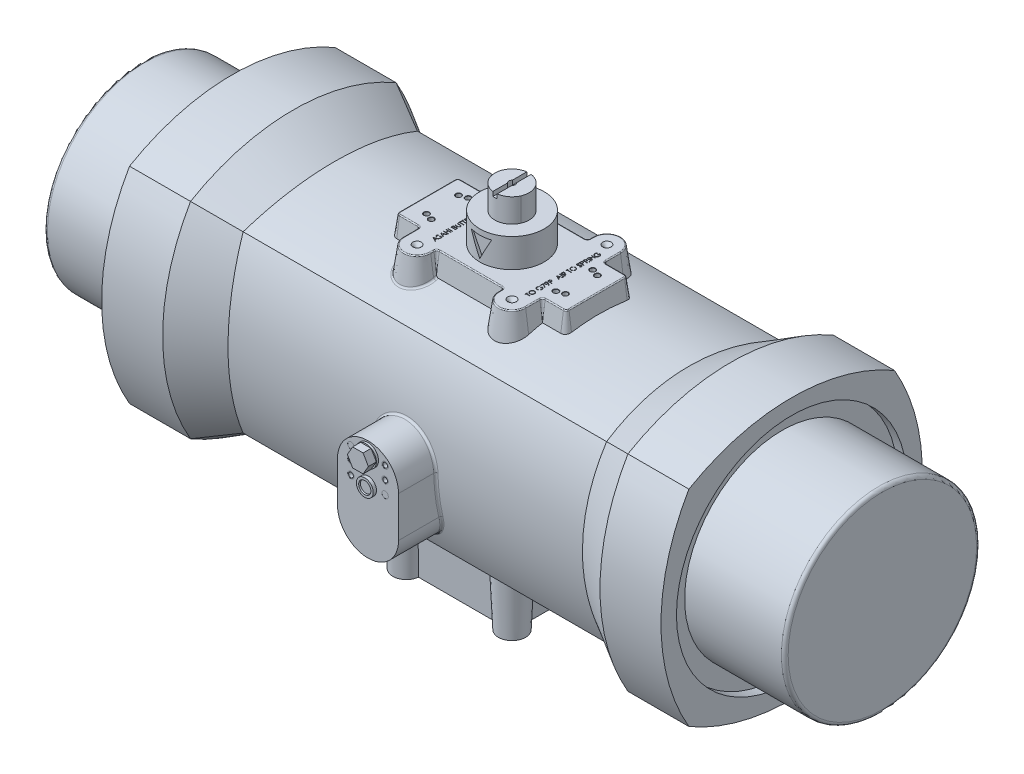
SolidWorks part; units mm, degrees
ref_plane "Front" through (0, 0, 0) normal (0, 0, 1) x (1, 0, 0)
ref_plane "Top" through (0, 0, 0) normal (0, 1, 0) x (1, 0, 0)
ref_plane "Right" through (0, 0, 0) normal (1, 0, 0) x (0, 0, -1)
sketch "Sketch1" plane through (0, 0, 0) normal (1, 0, 0) x (0, 0, -1)
  line L0 (0, 0) -> (-111.6723, 0) construction
  line L1 (0, 0) -> (0, 113.5403) construction
  circle A0 centre (0, 0) radius 72.39 construction
  circle A1 centre (0, 0) radius 100.0125 construction
  arc A2 (81.6346, 81.6346) -> (-81.6346, 81.6346) centre (0, -90.4875) ccw
  arc A3 (81.6346, -81.6346) -> (-81.6346, -81.6346) centre (0, 90.4875) cw
  arc A4 (-81.6346, 81.6346) -> (-81.6346, -81.6346) centre (90.4875, 0) ccw
  arc A5 (81.6346, 81.6346) -> (81.6346, -81.6346) centre (-90.4875, 0) cw
  dimension "D1" = 144.78
  dimension "D2" = 200.025
  dimension "D3" = 381
  dimension "D4" = 381
extrude "BODY DIA" add sketch "Sketch1" along normal mid plane 524.002
sketch "Sketch2" plane through (262.001, 0, 0) normal (1, 0, 0) x (0, 0, -1)
  line L0 (0, 0) -> (0, 112.2833) construction
  line L1 (0, 0) -> (-109.8095, 0) construction
  arc A0 (96.2969, 96.2969) -> (-96.2969, 96.2969) centre (0, -68.072) ccw
  arc A1 (96.2969, -96.2969) -> (-96.2969, -96.2969) centre (0, 68.072) cw
  arc A2 (-96.2969, 96.2969) -> (-96.2969, -96.2969) centre (68.072, 0) ccw
  arc A3 (96.2969, 96.2969) -> (96.2969, -96.2969) centre (-68.072, 0) cw
  circle A4 centre (0, 0) radius 122.428 construction
  dimension "D3" = 244.856
  dimension "D1" = 381
  dimension "D2" = 381
extrude "END1" add sketch "Sketch2" against normal blind 57.15
mirror "END2" about plane through (0, 0, 0) normal (1, 0, 0) of "END1"
sketch "Sketch3" plane through (204.851, 0, 0) normal (-1, 0, 0) x (0, 0, 1)
  arc A5 (96.2969, -96.2969) -> (96.2969, 96.2969) centre (-68.072, 0) ccw construction
  arc A6 (-96.2969, -96.2969) -> (96.2969, -96.2969) centre (0, 68.072) ccw construction
  arc A7 (-96.2969, 96.2969) -> (-96.2969, -96.2969) centre (68.072, 0) ccw construction
  arc A8 (96.2969, 96.2969) -> (-96.2969, 96.2969) centre (0, -68.072) ccw construction
  arc A9 (96.2969, -96.2969) -> (96.2969, 96.2969) centre (-68.072, 0) ccw
  arc A10 (-96.2969, -96.2969) -> (96.2969, -96.2969) centre (0, 68.072) ccw
  arc A11 (-96.2969, 96.2969) -> (-96.2969, -96.2969) centre (68.072, 0) ccw
  arc A12 (96.2969, 96.2969) -> (-96.2969, 96.2969) centre (0, -68.072) ccw
extrude "END DRAFT1" add sketch "Sketch3" along normal blind 50.8 draft 30
mirror "END DRAFT2" about plane through (0, 0, 0) normal (1, 0, 0) of "END DRAFT1"
sketch "Sketch4" plane through (262.001, 0, 0) normal (1, 0, 0) x (0, 0, -1)
  circle A0 centre (0, 0) radius 107.95
  circle A1 centre (0, 0) radius 91.44
  dimension "D1" = 16.51
  dimension "D2" = 215.9
extrude "END DIA DETAIL1" cut sketch "Sketch4" against normal blind 8.89
mirror "END DIA DETAIL2" about plane through (0, 0, 0) normal (1, 0, 0) of "END DIA DETAIL1"
ref_plane "Plane1" through (0, -147.32, 0) normal (0, 1, 0) x (-1, 0, 0)
ref_plane "Plane2" through (0, 115.57, 0) normal (0, 1, 0) x (-1, 0, 0)
sketch "Sketch5" plane through (0, -147.32, 0) normal (0, 1, 0) x (-1, 0, 0)
  line L0 (0, 0) -> (0, 75.2294) construction
  line L1 (0, 0) -> (92.8969, 0) construction
  line L2 (-49.4812, 49.4812) -> (0, 0) construction
  line L5 (50.8, 36.8499) -> (50.8, -36.8499)
  line L6 (36.8499, -50.8) -> (-36.8499, -50.8)
  line L7 (-50.8, 36.8499) -> (-50.8, -36.8499)
  line L8 (36.8499, 50.8) -> (-36.8499, 50.8)
  circle A0 centre (0, 0) radius 69.977 construction
  arc A1 (57.8778, 41.0847) -> (41.0847, 57.8778) centre (49.4812, 49.4812) ccw construction
  arc A2 (-57.8778, 41.0847) -> (-41.0847, 57.8778) centre (-49.4812, 49.4812) cw construction
  arc A3 (-57.8778, -41.0847) -> (-41.0847, -57.8778) centre (-49.4812, -49.4812) ccw construction
  arc A4 (57.8778, -41.0847) -> (41.0847, -57.8778) centre (49.4812, -49.4812) cw construction
  arc A5 (-36.8499, 50.8) -> (-50.8, 36.8499) centre (-49.4812, 49.4812) ccw
  arc A6 (50.8, 36.8499) -> (36.8499, 50.8) centre (49.4812, 49.4812) ccw
  arc A7 (36.8499, -50.8) -> (50.8, -36.8499) centre (49.4812, -49.4812) ccw
  arc A8 (-50.8, -36.8499) -> (-36.8499, -50.8) centre (-49.4812, -49.4812) ccw
  dimension "D1" = 139.954
  dimension "D4" = 23.749
  dimension "D5" = 101.6
  dimension "D6" = 101.6
  dimension "D3" = 25.4
  dimension "D2" = 45
extrude "Extrude4" add sketch "Sketch5" along normal up to next draft 2.5
sketch "Sketch6" plane through (0, -147.32, 0) normal (0, -1, 0) x (1, 0, 0)
  circle A0 centre (0, 0) radius 28.575
  circle A1 centre (0, 0) radius 28.321
  dimension "D1" = 57.15
  dimension "D2" = 0.254
extrude "Cut-Extrude2" cut sketch "Sketch6" against normal blind 19.05
sketch "Sketch7" plane through (0, -147.32, 0) normal (0, -1, 0) x (1, 0, 0)
  line L0 (0, 0) -> (0, 14.5007) construction
  line L1 (0, 0) -> (-14.398, 0) construction
  line L2 (-1.0139, 24.49) -> (-7.4699, 18.034)
  line L3 (-16.6001, 18.034) -> (-7.4699, 18.034)
  line L4 (-18.034, 16.6001) -> (-18.034, 7.4699)
  line L5 (-16.6001, -18.034) -> (-7.4699, -18.034)
  line L6 (18.034, 16.6001) -> (18.034, 7.4699)
  line L7 (-24.49, -1.0139) -> (-18.034, -7.4699)
  line L8 (1.0139, -24.49) -> (7.4699, -18.034)
  line L9 (24.49, 1.0139) -> (18.034, 7.4699)
  line L10 (0, 0) -> (-10.2431, 10.2431) construction
  line L11 (0, 0) -> (10.2285, 10.2285) construction
  line L12 (7.4699, -18.034) -> (16.6001, -18.034)
  line L13 (-7.4699, -18.034) -> (-1.0139, -24.49)
  line L14 (-18.034, -7.4699) -> (-18.034, -16.6001)
  line L15 (-18.034, 7.4699) -> (-24.49, 1.0139)
  line L16 (7.4699, 18.034) -> (16.6001, 18.034)
  line L17 (7.4699, 18.034) -> (1.0139, 24.49)
  line L18 (18.034, -7.4699) -> (18.034, -16.6001)
  line L19 (18.034, -7.4699) -> (24.49, -1.0139)
  arc A0 (-24.49, 1.0139) -> (-24.49, -1.0139) centre (0, 0) ccw
  arc A1 (-18.034, -16.6001) -> (-16.6001, -18.034) centre (0, 0) ccw
  arc A2 (-1.0139, -24.49) -> (1.0139, -24.49) centre (0, 0) ccw
  arc A3 (16.6001, -18.034) -> (18.034, -16.6001) centre (0, 0) ccw
  arc A4 (24.49, -1.0139) -> (24.49, 1.0139) centre (0, 0) ccw
  arc A5 (18.034, 16.6001) -> (16.6001, 18.034) centre (0, 0) ccw
  arc A6 (1.0139, 24.49) -> (-1.0139, 24.49) centre (0, 0) ccw
  arc A7 (-16.6001, 18.034) -> (-18.034, 16.6001) centre (0, 0) ccw
  dimension "D7" = 49.022
  dimension "D1" = 45
  dimension "D2" = 45
  dimension "D6" = 36.068
extrude "Cut-Extrude3" cut sketch "Sketch7" against normal blind 38.1
sketch "Sketch8" plane through (0, -147.32, 0) normal (0, -1, 0) x (1, 0, 0)
  line L0 (0, 0) -> (0, 59.2339) construction
  line L1 (0, 0) -> (94.2921, 0) construction
  line L2 (0, 0) -> (49.4812, 49.4812) construction
  line L3 (-49.4812, 49.4812) -> (49.4812, -49.4812) construction
  circle A0 centre (0, 0) radius 69.977 construction
  circle A1 centre (49.4812, 49.4812) radius 4.0386
  circle A2 centre (-49.4812, 49.4812) radius 4.0386
  circle A3 centre (49.4812, -49.4812) radius 4.0386
  circle A4 centre (-49.4812, -49.4812) radius 4.0386
  dimension "D2" = 139.954
  dimension "D3" = 8.0772
  dimension "D1" = 45
extrude "Cut-Extrude4" cut sketch "Sketch8" against normal blind 24.892
sketch "Sketch10" plane through (0, 115.57, 0) normal (0, 1, 0) x (-1, 0, 0)
  line L0 (0, 0) -> (0, 35.4582) construction
  line L1 (0, 0) -> (-53.975, 0) construction
  line L2 (40.005, -14.986) -> (46.3989, -21.3799) construction
  line L3 (40.005, -14.986) -> (40.005, -37.9386) construction
  line L4 (42.4207, -25.3582) -> (41.0307, -23.9682) construction
  line L5 (50.3772, -17.4017) -> (43.9833, -11.0077) construction
  line L6 (50.3772, 17.4017) -> (43.9833, 11.0077) construction
  line L7 (42.4207, 25.3582) -> (41.0307, 23.9682) construction
  line L8 (-42.4207, 25.3582) -> (-41.0307, 23.9682) construction
  line L9 (-50.3772, 17.4017) -> (-43.9833, 11.0077) construction
  line L10 (-42.4207, -25.3582) -> (-41.0307, -23.9682) construction
  line L11 (-50.3772, -17.4017) -> (-43.9833, -11.0077) construction
  line L12 (0, 0) -> (-19.9305, 19.9305) construction
  line L13 (37.398, -10.0004) -> (21.2762, -18.4304) construction
  line L14 (29.3973, -28.8991) -> (33.6634, -24.1611) construction
  line L15 (-37.398, -10.0004) -> (-21.2762, -18.4304) construction
  line L16 (-29.3973, -28.8991) -> (-33.6634, -24.1611) construction
  line L17 (37.398, 10.0004) -> (21.2762, 18.4304) construction
  line L18 (29.3973, 28.8991) -> (33.6634, 24.1611) construction
  line L19 (-37.398, 10.0004) -> (-21.2762, 18.4304) construction
  line L20 (-29.3973, 28.8991) -> (-33.6634, 24.1611) construction
  line L21 (36.4676, -50.8) -> (-36.4676, -50.8) construction
  line L22 (53.975, -44.45) -> (53.975, 44.45) construction
  line L23 (-53.975, -44.45) -> (-53.975, 44.45) construction
  line L24 (0, 0) -> (0, -71.0071) construction
  line L25 (36.4676, 50.8) -> (-36.4676, 50.8) construction
  line L26 (0, 0) -> (53.975, 0) construction
  line L27 (42.2227, -47.1336) -> (53.3801, -23.2065) construction
  line L28 (-42.2227, -47.1336) -> (-53.3801, -23.2065) construction
  line L29 (42.2227, 47.1336) -> (53.3801, 23.2065) construction
  line L30 (-42.2227, 47.1336) -> (-53.3801, 23.2065) construction
  line L31 (-53.975, -20.5229) -> (-53.975, 20.5229) construction
  line L32 (53.975, 20.5229) -> (53.975, -20.5229) construction
  line L33 (79.375, -26.035) -> (79.375, 26.035)
  line L34 (-79.375, -26.035) -> (-79.375, 26.035)
  line L35 (76.835, -28.575) -> (59.69, -28.575)
  line L36 (76.835, 28.575) -> (59.69, 28.575)
  line L37 (29.21, -38.8938) -> (-29.21, -38.8938)
  line L38 (-57.15, -44.45) -> (-57.15, -31.115)
  line L39 (44.45, -44.45) -> (44.45, 44.45) construction
  line L40 (-44.45, -44.45) -> (-44.45, 44.45) construction
  line L41 (29.21, 38.8937) -> (-29.21, 38.8938)
  line L42 (57.15, -44.45) -> (57.15, -31.115)
  line L43 (-57.15, 44.45) -> (-57.15, 31.115)
  line L44 (57.15, 44.45) -> (57.15, 31.115)
  line L48 (-59.69, 28.575) -> (-76.835, 28.575)
  line L50 (-59.69, -28.575) -> (-76.835, -28.575)
  line L51 (-31.75, -44.45) -> (-31.75, -41.4338)
  line L52 (31.75, -44.45) -> (31.75, -41.4338)
  line L53 (31.75, 44.45) -> (31.75, 41.4338)
  line L54 (-31.75, 44.45) -> (-31.75, 41.4338)
  arc A0 (42.4207, -25.3582) -> (50.3772, -17.4017) centre (46.3989, -21.3799) ccw construction
  arc A1 (43.9833, 11.0077) -> (37.398, 10.0004) centre (40.005, 14.986) cw construction
  arc A2 (43.9833, -11.0077) -> (37.398, -10.0004) centre (40.005, -14.986) ccw construction
  arc A3 (42.4207, 25.3582) -> (50.3772, 17.4017) centre (46.3989, 21.3799) cw construction
  arc A4 (-42.4207, 25.3582) -> (-50.3772, 17.4017) centre (-46.3989, 21.3799) ccw construction
  arc A5 (-43.9833, 11.0077) -> (-37.398, 10.0004) centre (-40.005, 14.986) ccw construction
  arc A6 (-43.9833, -11.0077) -> (-37.398, -10.0004) centre (-40.005, -14.986) cw construction
  arc A7 (-42.4207, -25.3582) -> (-50.3772, -17.4017) centre (-46.3989, -21.3799) cw construction
  circle A8 centre (0, 0) radius 34.5 construction
  arc A9 (-21.2762, 18.4304) -> (-29.3973, 28.8991) centre (-24.3952, 24.3952) ccw construction
  arc A10 (-21.2762, -18.4304) -> (-29.3973, -28.8991) centre (-24.3952, -24.3952) cw construction
  arc A11 (21.2762, 18.4304) -> (29.3973, 28.8991) centre (24.3952, 24.3952) cw construction
  arc A12 (21.2762, -18.4304) -> (29.3973, -28.8991) centre (24.3952, -24.3952) ccw construction
  arc A13 (33.6634, -24.1611) -> (41.0307, -23.9682) centre (37.4386, -27.5603) cw construction
  arc A14 (-41.0307, -23.9682) -> (-33.6634, -24.1611) centre (-37.4386, -27.5603) cw construction
  arc A15 (-41.0307, 23.9682) -> (-33.6634, 24.1611) centre (-37.4386, 27.5603) ccw construction
  arc A16 (41.0307, 23.9682) -> (33.6634, 24.1611) centre (37.4386, 27.5603) cw construction
  arc A17 (36.4676, -50.8) -> (42.2227, -47.1336) centre (36.4676, -44.45) ccw construction
  arc A18 (-42.2227, -47.1336) -> (-36.4676, -50.8) centre (-36.4676, -44.45) ccw construction
  arc A19 (-53.3801, 23.2065) -> (-53.975, 20.5229) centre (-47.625, 20.5229) ccw construction
  arc A20 (53.975, 20.5229) -> (53.3801, 23.2065) centre (47.625, 20.5229) ccw construction
  arc A21 (36.4676, 50.8) -> (42.2227, 47.1336) centre (36.4676, 44.45) cw construction
  arc A22 (-42.2227, 47.1336) -> (-36.4676, 50.8) centre (-36.4676, 44.45) cw construction
  arc A23 (53.3801, -23.2065) -> (53.975, -20.5229) centre (47.625, -20.5229) ccw construction
  arc A24 (-53.975, -20.5229) -> (-53.3801, -23.2065) centre (-47.625, -20.5229) ccw construction
  arc A25 (-57.15, -44.45) -> (-31.75, -44.45) centre (-44.45, -44.45) ccw
  arc A26 (57.15, -44.45) -> (31.75, -44.45) centre (44.45, -44.45) cw
  arc A27 (-57.15, 44.45) -> (-31.75, 44.45) centre (-44.45, 44.45) cw
  arc A28 (57.15, 44.45) -> (31.75, 44.45) centre (44.45, 44.45) ccw
  arc A29 (76.835, -28.575) -> (79.375, -26.035) centre (76.835, -26.035) ccw
  arc A30 (76.835, 28.575) -> (79.375, 26.035) centre (76.835, 26.035) cw
  arc A31 (-79.375, -26.035) -> (-76.835, -28.575) centre (-76.835, -26.035) ccw
  arc A32 (-76.835, 28.575) -> (-79.375, 26.035) centre (-76.835, 26.035) ccw
  arc A33 (-59.69, 28.575) -> (-57.15, 31.115) centre (-59.69, 31.115) ccw
  arc A34 (-31.75, 41.4338) -> (-29.21, 38.8938) centre (-29.21, 41.4338) ccw
  arc A35 (29.21, 38.8937) -> (31.75, 41.4338) centre (29.21, 41.4337) ccw
  arc A36 (59.69, 28.575) -> (57.15, 31.115) centre (59.69, 31.115) cw
  arc A37 (57.15, -31.115) -> (59.69, -28.575) centre (59.69, -31.115) cw
  arc A38 (29.21, -38.8938) -> (31.75, -41.4338) centre (29.21, -41.4338) cw
  arc A39 (-31.75, -41.4338) -> (-29.21, -38.8938) centre (-29.21, -41.4338) cw
  arc A40 (-59.69, -28.575) -> (-57.15, -31.115) centre (-59.69, -31.115) cw
  point P22 (37.2454, -20.1829)
  point P36 (-37.2454, -20.1829)
  point P55 (-37.2454, 20.1829)
  point P58 (37.2454, 20.1829)
  point P59 (0, 50.8)
  point P60 (0, -50.8)
  point P75 (-43.3718, 54.9152)
  point P78 (40.513, -50.8)
  point P81 (-40.513, -50.8)
  point P84 (-53.975, 21.9306)
  point P87 (53.975, 21.9306)
  point P90 (40.513, 50.8)
  point P93 (-40.513, 50.8)
  point P96 (53.975, -21.9306)
  point P99 (-53.975, -21.9306)
  point P110 (44.45, 0)
  point P134 (-57.15, 28.575)
  point P142 (57.15, 28.575)
  point P145 (57.15, -28.575)
  point P148 (31.75, -38.8938)
  point P151 (-31.75, -38.8938)
  point P154 (-57.15, -28.575)
  dimension "D1" = 40.005
  dimension "D4" = 45
  dimension "D3" = 11.2522
  dimension "D7" = 69
  dimension "D8" = 13.462
  dimension "D10" = 5.08
  dimension "D13" = 81.026
  dimension "D15" = 65
  dimension "D18" = 158.75
  dimension "D14" = 81.026
  dimension "D17" = 6.35
  dimension "D23" = 25.4
  dimension "D24" = 2.54
  dimension "D2" = 14.986
  dimension "D5" = 45
  dimension "D6" = 9.0424
  dimension "D9" = 48
  dimension "D11" = 107.95
  dimension "D12" = 50.8
  dimension "D16" = 65
  dimension "D19" = 57.15
  dimension "D20" = 77.7875
  dimension "D21" = 88.9
  dimension "D22" = 88.9
extrude "Extrude5" add sketch "Sketch10" against normal up to next draft 8
ref_plane "Plane3" through (0, 165.608, 0) normal (0, 1, 0) x (-1, 0, 0)
ref_plane "Plane4" through (0, 0, 134.874) normal (0, 0, 1) x (1, 0, 0)
ref_plane "Plane5" through (0, 0, 144.3863) normal (0, 0, 1) x (1, 0, 0)
sketch "Sketch23"
  dimension "D1" = 63.5
sketch "Sketch24" plane through (0, -147.32, 0) normal (0, -1, 0) x (1, 0, 0)
  circle A0 centre (0, 0) radius 28.321 construction
  circle A1 centre (0, 0) radius 28.321
chamfer "Chamfer2" distance 0.508 angle 45 1 edges at (0, -147.32, -28.575)
ref_plane "Plane6" through (0, 136.906, 0) normal (0, 1, 0) x (-1, 0, 0)
sketch "Sketch26" plane through (0, 136.906, 0) normal (0, 1, 0) x (-1, 0, 0)
  circle A0 centre (0, 0) radius 18.2245
  dimension "D1" = 36.449
sketch "Sketch27" plane through (0, 165.608, 0) normal (0, 1, 0) x (-1, 0, 0)
  line L1 (0, 0) -> (0, -33.9544) construction
  arc A0 (-14.7755, 6.144) -> (16.002, 0) centre (0, 0) ccw
  arc A1 (16.002, 0) -> (-14.7755, 6.144) centre (0, 0) ccw
  dimension "D1" = 32.004
extrude "Extrude7" add sketch "Sketch27" against normal up to next
sketch "Sketch28" plane through (0, 165.608, 0) normal (0, 1, 0) x (1, 0, 0)
  line L0 (0, 0) -> (0, 19.8933) construction
  line L1 (-2.032, 15.8725) -> (-2.032, -15.8725)
  line L2 (2.032, 15.8725) -> (2.032, -15.8725)
  arc A0 (-16.002, 0) -> (14.7755, -6.144) centre (0, 0) ccw construction
  arc A2 (-2.032, -15.8725) -> (2.032, -15.8725) centre (0, 0) ccw
  arc A3 (2.032, 15.8725) -> (-2.032, 15.8725) centre (0, 0) ccw
  arc A4 (14.7755, -6.144) -> (-16.002, 0) centre (0, 0) ccw construction
  dimension "D1" = 4.064
extrude "Cut-Extrude15" cut sketch "Sketch28" against normal blind 4.064
extrude "ASAHI TEXT" cut sketch "Sketch23" against normal blind 0.0508
ref_plane "Plane7" through (0, 153.8732, 0) normal (0, 1, 0) x (-1, 0, 0)
sketch "Sketch29" plane through (0, 153.8732, 0) normal (0, 1, 0) x (-1, 0, 0)
  circle A0 centre (0, 0) radius 18.0975
  dimension "D1" = 36.195
sketch "Sketch33" plane through (0, 0, 134.874) normal (0, 0, 1) x (1, 0, 0)
  line L0 (0, 0) -> (0, 67.0544) construction
  line L1 (0, 0) -> (-65.5199, 0) construction
  line L2 (-22.9235, 15.4654) -> (-22.9235, -15.4654) construction
  line L3 (22.9235, 15.4654) -> (22.9235, -15.4654) construction
  line L4 (0, 23.876) -> (4.7625, 23.876) construction
  line L5 (0, -23.876) -> (4.7625, -23.876) construction
  line L6 (-1.2326, 23.7137) -> (-20.5703, 18.5322) construction
  line L7 (1.2326, 23.7137) -> (20.5703, 18.5322) construction
  line L8 (-1.2326, -23.7137) -> (-20.5703, -18.5322) construction
  line L9 (1.2326, -23.7137) -> (20.5703, -18.5322) construction
  line L10 (0, 23.876) -> (34.1115, 23.876) construction
  line L11 (0, -71.374) -> (25.6519, -71.374) construction
  line L13 (-28.575, -4.699) -> (-28.575, -42.799)
  line L14 (28.575, -4.699) -> (28.575, -42.799)
  arc A0 (1.2326, 23.7137) -> (-1.2326, 23.7137) centre (0, 19.1135) ccw construction
  arc A1 (1.2326, -23.7137) -> (-1.2326, -23.7137) centre (0, -19.1135) cw construction
  arc A2 (22.9235, 15.4654) -> (20.5703, 18.5322) centre (19.7485, 15.4654) ccw construction
  arc A3 (20.5703, -18.5322) -> (22.9235, -15.4654) centre (19.7485, -15.4654) ccw construction
  arc A4 (-22.9235, -15.4654) -> (-20.5703, -18.5322) centre (-19.7485, -15.4654) ccw construction
  arc A5 (-20.5703, 18.5322) -> (-22.9235, 15.4654) centre (-19.7485, 15.4654) ccw construction
  arc A6 (28.575, -4.699) -> (-28.575, -4.699) centre (0, -4.699) ccw
  arc A9 (-28.575, -42.799) -> (28.575, -42.799) centre (0, -42.799) ccw
  dimension "D2" = 9.525
  dimension "D5" = 3.175
  dimension "D6" = 57.15
  dimension "D7" = 28.575
  dimension "D1" = 45.847
  dimension "D3" = 47.752
  dimension "D4" = 75
  dimension "D8" = 95.25
extrude "Extrude11" add sketch "Sketch33" against normal up to next
sketch "Sketch35" plane through (0, 0, 144.3863) normal (0, 0, 1) x (1, 0, 0)
  line L0 (0, 0) -> (0, 67.4251) construction
  line L1 (0, 0) -> (-67.3734, 0) construction
  line L3 (4.92, 4.1021) -> (9.84, 12.6238)
  line L4 (9.84, 12.6238) -> (4.92, 21.1455)
  line L5 (4.92, 21.1455) -> (-4.92, 21.1455)
  line L6 (-4.92, 21.1455) -> (-9.84, 12.6238)
  line L7 (-9.84, 12.6238) -> (-4.92, 4.1021)
  line L8 (-4.92, 4.1021) -> (4.92, 4.1021)
  circle A0 centre (0, 12.6238) radius 8.5217 construction
  dimension "D1" = 17.0434
  dimension "D2" = 12.6238
extrude "Extrude12" add sketch "Sketch35" against normal up to next
sketch "Sketch36" plane through (0, 0, 134.874) normal (0, 0, 1) x (1, 0, 0)
  line L0 (4.92, 21.1455) -> (-4.92, 4.1021) construction
  circle A0 centre (0, 12.6238) radius 9.84
  point P7 (0, 12.6238)
extrude "Extrude13" add sketch "Sketch36" along normal blind 2.032
sketch "Sketch37" plane through (0, 0, 134.874) normal (0, 0, 1) x (1, 0, 0)
  line L0 (0, 0) -> (64.7785, 0) construction
  line L1 (0, 0) -> (0, 67.0544) construction
  line L2 (0, 0) -> (0, -49.343) construction
  line L3 (0, 0) -> (-65.1492, 0) construction
  circle A0 centre (0, -12.6238) radius 7.9248
  dimension "D2" = 15.8496
  dimension "D1" = 12.6238
extrude "Extrude14" add sketch "Sketch37" along normal blind 3.048
sketch "Sketch38" plane through (0, 0, 137.922) normal (0, 0, 1) x (1, 0, 0)
  circle A0 centre (0, -12.6238) radius 5.715
  dimension "D1" = 11.43
extrude "Cut-Extrude18" cut sketch "Sketch38" against normal blind 1.27 draft 15
sketch "Sketch39" plane through (0, 0, 134.874) normal (0, 0, 1) x (1, 0, 0)
  line L0 (0, 0) -> (0, 67.0544) construction
  line L1 (0, 0) -> (0, -51.0112) construction
  line L2 (0, 0) -> (-64.5932, 0) construction
  line L3 (0, 0) -> (65.7052, 0) construction
  line L4 (-16.002, 11.9888) -> (-16.002, -11.9888) construction
  line L5 (16.002, 11.9888) -> (16.002, -11.9888) construction
  circle A0 centre (-16.002, 0) radius 3.0226
  circle A1 centre (-16.002, 11.9888) radius 3.0226
  circle A2 centre (-16.002, -11.9888) radius 3.0226
  circle A3 centre (16.002, 11.9888) radius 3.0226
  circle A4 centre (16.002, 0) radius 3.0226
  circle A5 centre (16.002, -11.9888) radius 3.0226
  dimension "D3" = 6.0452
  dimension "D1" = 32.004
  dimension "D2" = 23.9776
extrude "Cut-Extrude19" cut sketch "Sketch39" against normal blind 0.0508
sketch "Sketch40" plane through (0, 0, 134.874) normal (0, 0, 1) x (1, 0, 0)
  circle A0 centre (-16.002, 0) radius 2.1971
  circle A1 centre (-16.002, -11.9888) radius 2.1971
  circle A2 centre (16.002, 0) radius 2.1971
  circle A3 centre (16.002, 11.9888) radius 2.1971
  dimension "D1" = 4.3942
extrude "Cut-Extrude20" cut sketch "Sketch40" against normal blind 8
fillet "Fillet6" radius 1 34 edges at (-3.1326, 115.57, 15.6924) (3.1326, 115.57, -15.6924) (-31.75, 115.57, -42.9419) (0, 115.57, -38.8938) (31.75, 115.57, -42.9419) (44.45, 115.57, -57.15) (57.15, 115.57, -37.7825) (68.2625, 115.57, -28.575) (79.375, 115.57, 0) (68.2625, 115.57, 28.575) (57.15, 115.57, 37.7825) (44.45, 115.57, 57.15) (31.75, 115.57, 42.9419) (0, 115.57, 38.8938) (-31.75, 115.57, 42.9419) (-44.45, 115.57, 57.15) (-57.15, 115.57, 37.7825) (-68.2625, 115.57, 28.575) (-79.375, 115.57, 0) (-68.2625, 115.57, -28.575) (-57.15, 115.57, -37.7825) (-44.45, 115.57, -57.15) (-31.0061, 115.57, -39.6377) (31.0061, 115.57, -39.6377) (57.8939, 115.57, -29.3189) (78.6311, 115.57, -27.8311) (78.6311, 115.57, 27.8311) (57.8939, 115.57, 29.3189) (31.0061, 115.57, 39.6377) (-31.0061, 115.57, 39.6377) (-57.8939, 115.57, 29.3189) (-78.6311, 115.57, 27.8311) (-78.6311, 115.57, -27.8311) (-57.8939, 115.57, -29.3189)
sketch "Sketch42" plane through (0, 115.57, 0) normal (0, 1, 0) x (1, 0, 0)
  line L0 (0, 0) -> (0, 73.8772) construction
  line L1 (0, 0) -> (-149.1515, 0) construction
  circle A0 centre (-44.45, 44.45) radius 3.9687
  circle A1 centre (44.45, 44.45) radius 3.9687
  circle A2 centre (44.45, -44.45) radius 3.9687
  circle A3 centre (-44.45, -44.45) radius 3.9687
  arc A4 (-32.6193, 44.45) -> (-56.2807, 44.45) centre (-44.45, 44.45) ccw construction
  dimension "D1" = 7.9375
extrude "Cut-Extrude21" cut sketch "Sketch42" against normal blind 10 draft 45
sketch "Sketch43" plane through (0, 115.57, 0) normal (0, 1, 0) x (1, 0, 0)
  line L0 (0, 0) -> (0, 73.8772) construction
  line L1 (0, 0) -> (-147.7394, 0) construction
  circle A0 centre (-58.3406, 17.272) radius 2.3812
  circle A1 centre (-65.024, 14.986) radius 2.3813
  circle A2 centre (-65.024, -14.986) radius 2.3813
  circle A3 centre (65.024, 14.986) radius 2.3813
  circle A4 centre (65.024, -14.986) radius 2.3813
  circle A5 centre (-58.3406, -17.272) radius 2.3812
  circle A6 centre (58.3406, 17.272) radius 2.3812
  circle A7 centre (58.3406, -17.272) radius 2.3812
  dimension "D1" = 116.6813
  dimension "D5" = 4.7625
  dimension "D2" = 34.544
  dimension "D3" = 130.048
  dimension "D4" = 29.972
extrude "Cut-Extrude22" cut sketch "Sketch43" against normal blind 6
chamfer "Chamfer3" distance 0.254 angle 45 8 edges at (65.024, 115.57, 17.3673) (65.024, 115.57, -12.6047) (58.3406, 115.57, -14.8907) (58.3406, 115.57, 19.6533) (-65.024, 115.57, 17.3673) (-58.3406, 115.57, 19.6533) (-58.3406, 115.57, -14.8907) (-65.024, 115.57, -12.6047)
sketch "Sketch44"
  dimension "D1" = 63.5
extrude "TEXT2" cut sketch "Sketch44" against normal blind 0.0508
sketch "Sketch45" plane through (0, 165.608, 0) normal (0, 1, 0) x (1, 0, 0)
  circle A0 centre (0, 0) radius 3.0861
  dimension "D1" = 6.1722
extrude "Cut-Extrude23" cut sketch "Sketch45" against normal blind 11.938
ref_plane "Plane8" through (0, 143.383, 0) normal (0, 1, 0) x (-1, 0, 0)
sketch "Sketch46" plane through (0, 143.383, 0) normal (0, 1, 0) x (-1, 0, 0)
  circle A0 centre (0, 0) radius 30.1625
  dimension "D1" = 60.325
extrude "Extrude15" add sketch "Sketch46" against normal blind 26.924
ref_plane "Plane10" through (0, 0, 30.1625) normal (0, 0, 1) x (1, 0, 0)
sketch "Sketch47" plane through (0, 0, 30.1625) normal (0, 0, 1) x (1, 0, 0)
  line L0 (0, 0) -> (0, 158.8154) construction
  line L1 (-9.525, 138.303) -> (9.525, 138.303)
  line L2 (14.7755, 143.383) -> (-16.002, 143.383) construction
  line L3 (-9.525, 138.303) -> (0, 119.253)
  line L4 (9.525, 138.303) -> (0, 119.253)
  point P5 (0, 138.303)
  dimension "D1" = 19.05
  dimension "D2" = 5.08
  dimension "D3" = 19.05
extrude "Cut-Extrude24" cut sketch "Sketch47" against normal blind 2.54
fillet "Fillet8" radius 2 15 edges at (-59.8691, 96.2226, 37.8097) (-28.8696, 95.0748, 43.0914) (-42.5597, 90.1107, 60.6179) (28.575, -23.8706, 98.511) (4.189, -71.0653, 86.2608) (-28.575, -23.8706, 98.511) (-3.1111, 23.7061, 98.5317) (58.8847, -89.8341, 61.4359) (-39.2867, -96.0685, 38.5631) (0, -92.4343, 53.1964) (52.8655, -100.0125, 0) (37.4663, -95.6414, -40.5742) (0, -92.4343, -53.1964) (-52.8655, -100.0125, 0) (-40.89, -96.3301, -37.2753)
sketch "Sketch48" plane through (262.001, 0, 0) normal (1, 0, 0) x (0, 0, -1)
  circle A0 centre (0, 0) radius 91.44 construction
  circle A1 centre (0, 0) radius 91.44
extrude "Extrude16" add sketch "Sketch48" along normal blind 84.963
mirror "Mirror1" about plane through (0, 0, 0) normal (1, 0, 0) of "Extrude16"
fillet "Fillet9" radius 3.175 2 edges at (346.964, 0, -91.44) (-346.964, 0, -91.44)
sketch "Sketch49"
extrude "Cut-Extrude25" cut sketch "Sketch49" against normal blind 5.08
